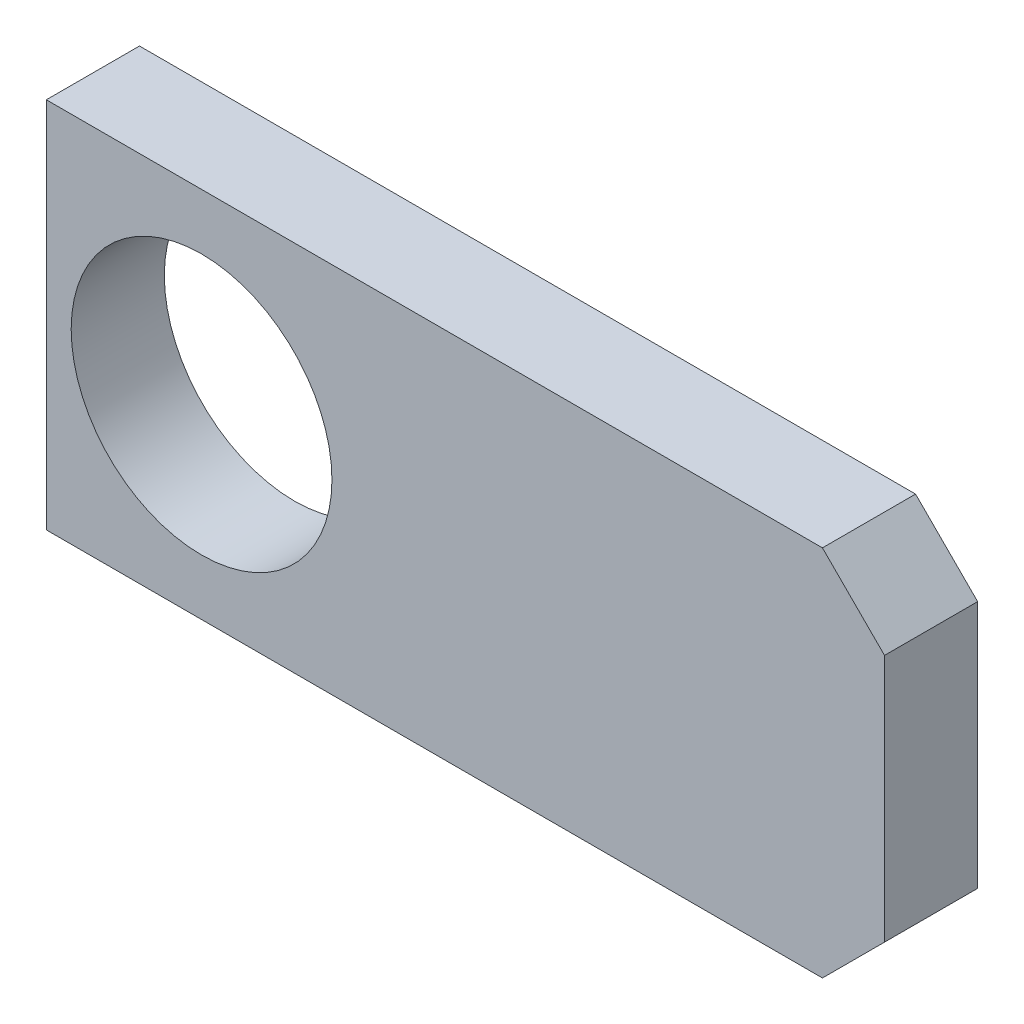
SolidWorks part; units mm, degrees
ref_plane "Face" through (0, 0, 0) normal (0, 0, 1) x (1, 0, 0)
ref_plane "Dessus" through (0, 0, 0) normal (0, 1, 0) x (1, 0, 0)
ref_plane "Droite" through (0, 0, 0) normal (1, 0, 0) x (0, 0, -1)
sketch "Esquisse1" plane through (0, 0, 0) normal (0, 0, 1) x (1, 0, 0)
  line L1 (0, 0) -> (135, 0)
  line L2 (0, 0) -> (0, 60)
  line L3 (0, 60) -> (135, 60)
  line L4 (135, 0) -> (135, 60)
  dimension "D1" = 135
  dimension "D2" = 60
extrude "Base-Extrusion" add sketch "Esquisse1" along normal blind 15
sketch "Esquisse2" plane through (0, 0, 15) normal (0, 0, 1) x (1, 0, 0)
  line L0 (0, 30) -> (130.9178, 30) construction
  line L1 (0, 60) -> (0, 0) construction
  circle A0 centre (25, 30) radius 21
  dimension "D1" = 42
  dimension "D2" = 25
extrude "Enlèv. mat.-Extru.1" cut sketch "Esquisse2" against normal through all
chamfer "Chanfrein1" distance 10 angle 45
